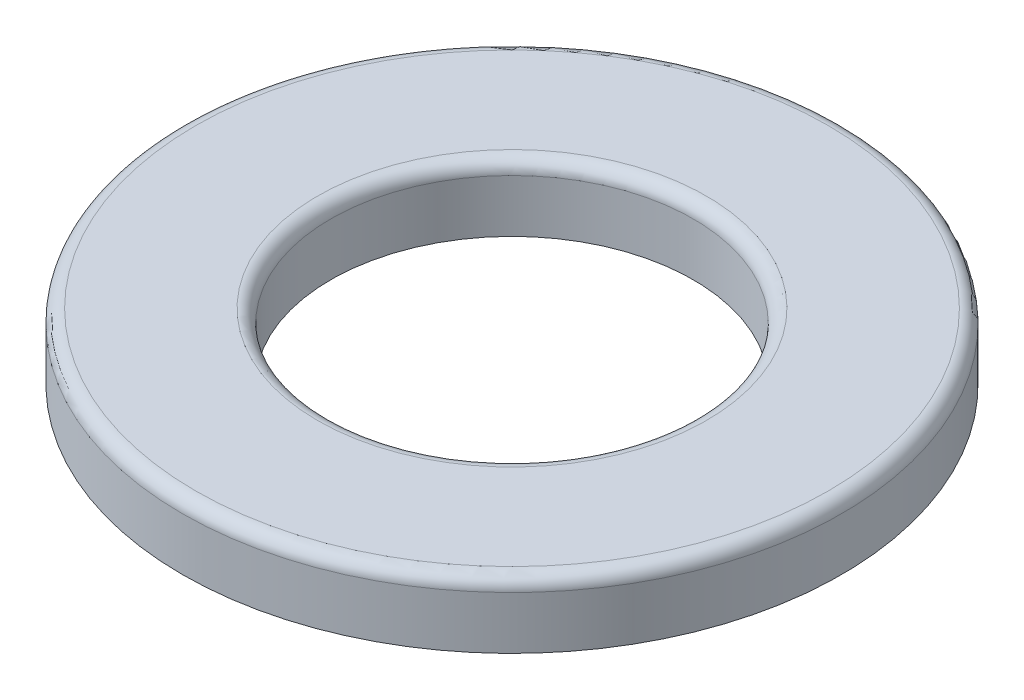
SolidWorks part; units mm, degrees
ref_plane "前视基准面" through (0, 0, 0) normal (0, 0, 1) x (1, 0, 0)
ref_plane "上视基准面" through (0, 0, 0) normal (0, 1, 0) x (1, 0, 0)
ref_plane "右视基准面" through (0, 0, 0) normal (1, 0, 0) x (0, 0, -1)
sketch "草图1" plane through (0, 0, 0) normal (0, 1, 0) x (1, 0, 0)
  circle A0 centre (0, 0) radius 5
  circle A1 centre (0, 0) radius 2.75
  dimension "D1" = 5.5
  dimension "D2" = 10
extrude "凸台-拉伸1" add sketch "草图1" along normal mid plane 1
fillet "圆角1" radius 0.2 2 edges at (0, 0.5, 5) (0, 0.5, 2.75)
